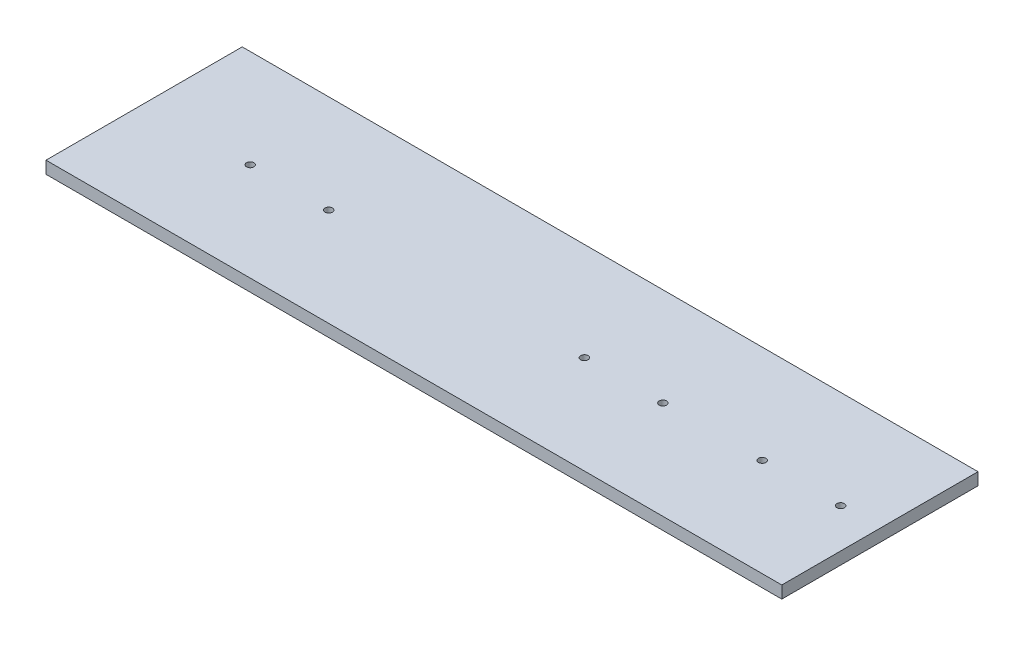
SolidWorks part; units mm, degrees
ref_plane "Front Plane" through (0, 0, 0) normal (0, 0, 1) x (1, 0, 0)
ref_plane "Top Plane" through (0, 0, 0) normal (0, 1, 0) x (1, 0, 0)
ref_plane "Right Plane" through (0, 0, 0) normal (1, 0, 0) x (0, 0, -1)
sketch "Sketch1" plane through (0, 0, 0) normal (0, 1, 0) x (1, 0, 0)
  line L1 (-300, -80) -> (300, -80)
  line L2 (-300, -80) -> (-300, 80)
  line L3 (-300, 80) -> (300, 80)
  line L4 (300, -80) -> (300, 80)
  line L5 (-300, -80) -> (300, 80) construction
  line L6 (-300, 80) -> (300, -80) construction
  point P0 (0, 0)
  dimension "D1" = 600
  dimension "D2" = 160
extrude "Boss-Extrude1" add sketch "Sketch1" along normal blind 10
sketch "Sketch2" plane through (0, 0, 0) normal (0, -1, 0) x (1, 0, 0)
  circle A0 centre (-213.4733, 0) radius 3
  circle A1 centre (-149.4733, 0) radius 3
  circle A2 centre (59, 0) radius 3
  circle A3 centre (123, 0) radius 3
  circle A4 centre (204, 0) radius 3
  circle A5 centre (268, 0) radius 3
  dimension "D1" = 6
extrude "Cut-Extrude1" cut sketch "Sketch2" against normal blind 10
